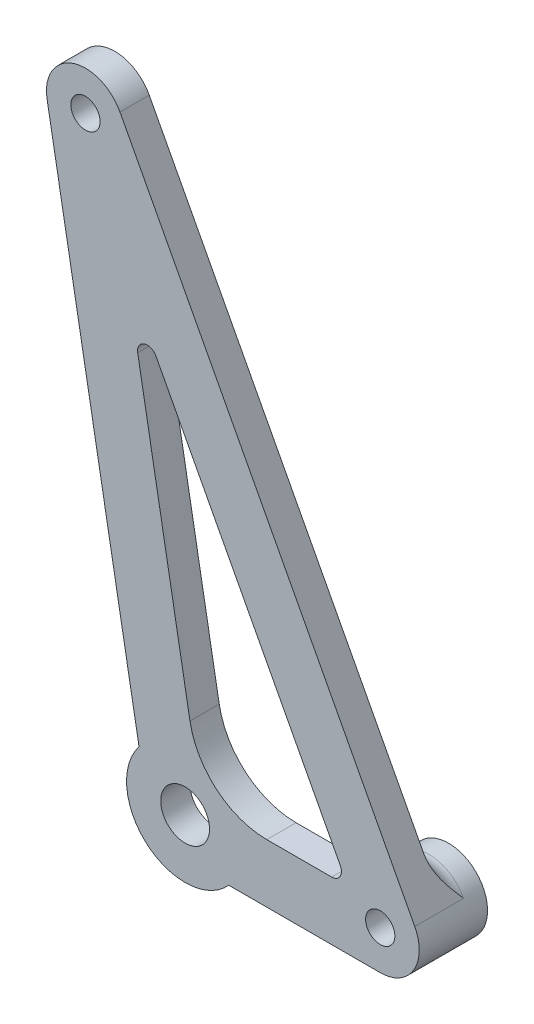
SolidWorks part; units mm, degrees
ref_plane "前视基准面" through (0, 0, 0) normal (0, 0, 1) x (1, 0, 0)
ref_plane "上视基准面" through (0, 0, 0) normal (0, 1, 0) x (1, 0, 0)
ref_plane "右视基准面" through (0, 0, 0) normal (1, 0, 0) x (0, 0, -1)
sketch "草图1" plane through (0, 0, 0) normal (0, 0, 1) x (1, 0, 0)
  line L0 (-31.7103, 56.4832) -> (-22.2851, 3.6994)
  line L1 (-21.2268, 0) -> (-20.0612, 0) construction
  line L2 (-13.0891, -4) -> (2.4388, -4)
  line L3 (5.9755, 1.8685) -> (-24.2358, 59.0548)
  line L4 (-22.4213, 38.5955) -> (-17.0641, 8.5937)
  line L5 (-1.6549, 3.4671) -> (-20.5527, 39.2384)
  line L6 (-9.1887, 2) -> (-2.539, 2)
  line L7 (-25.8037, 57.5379) -> (-16.3785, 4.7541) construction
  line L8 (0.9388, 0) -> (2.4388, 0)
  line L9 (0.9388, 0) -> (6.1043, 0) construction
  line L10 (0.6704, -0.9342) -> (-29.541, 56.2521) construction
  line L11 (-13.0891, 2) -> (2.4388, 2) construction
  circle A0 centre (-17.5612, 0) radius 2.5
  circle A1 centre (2.4388, 0) radius 1.5
  arc A2 (-9.1887, 2) -> (-17.0641, 8.5937) centre (-9.1887, 10) cw
  arc A3 (-24.2358, 59.0548) -> (-31.7103, 56.4832) centre (-27.7726, 57.1864) ccw
  circle A4 centre (-27.7726, 57.1864) radius 1.5
  arc A5 (-22.2851, 3.6994) -> (-13.0891, -4) centre (-17.5612, 0) ccw
  arc A6 (2.4388, -4) -> (5.9755, 1.8685) centre (2.4388, 0) ccw
  arc A7 (-22.4213, 38.5955) -> (-20.5527, 39.2384) centre (-21.4369, 38.7713) cw
  arc A8 (-2.539, 2) -> (-1.6549, 3.4671) centre (-2.539, 3) ccw
  dimension "D1" = 6
  dimension "D2" = 8
  dimension "D3" = 1
  dimension "D4" = 1
extrude "凸台-拉伸1" add sketch "草图1" along normal blind 3
sketch "草图2" plane through (0, 0, 0) normal (0, 0, -1) x (-1, 0, 0)
  circle A0 centre (-2.4388, 0) radius 1.5 construction
  circle A1 centre (-2.4388, 0) radius 1.5
  circle A2 centre (-2.4388, 0) radius 4
extrude "凸台-拉伸2" add sketch "草图2" along normal blind 4
fillet "圆角1" radius 2 1 edges
